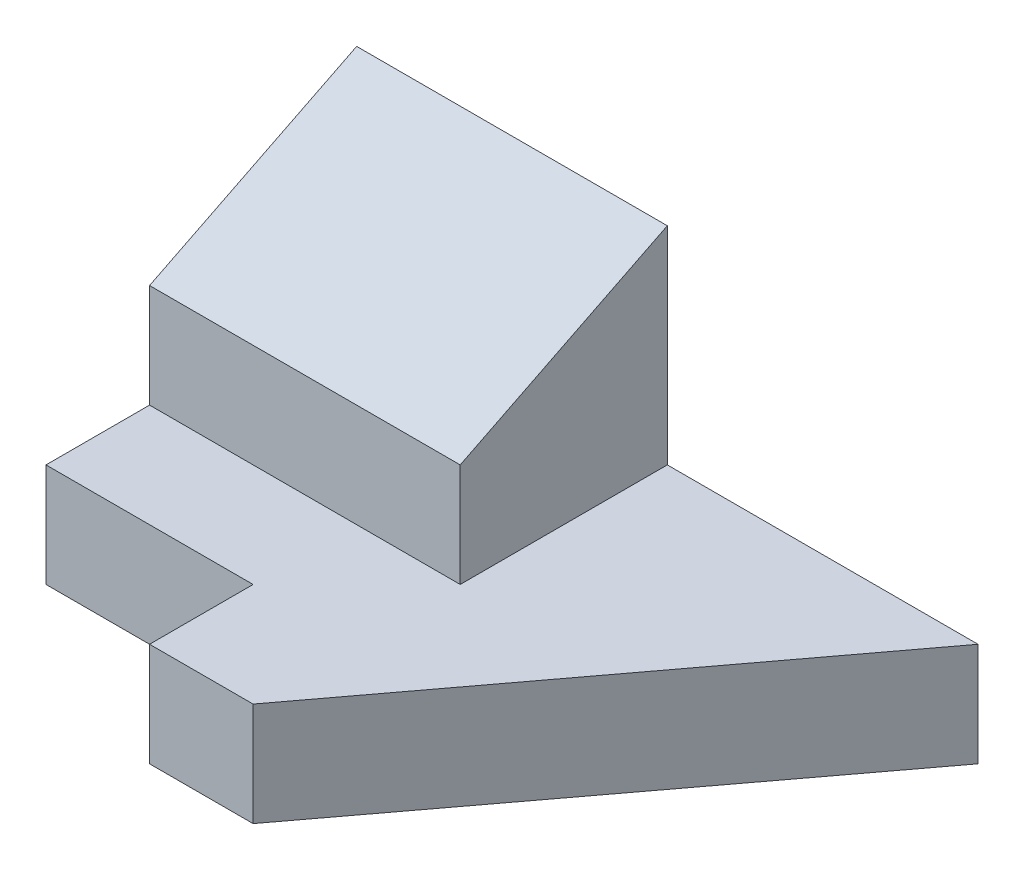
SolidWorks part; units mm, degrees
ref_plane "Front Plane" through (0, 0, 0) normal (0, 0, 1) x (1, 0, 0)
ref_plane "Top Plane" through (0, 0, 0) normal (0, 1, 0) x (1, 0, 0)
ref_plane "Right Plane" through (0, 0, 0) normal (1, 0, 0) x (0, 0, -1)
sketch "Sketch1" plane through (0, 0, 0) normal (0, 1, 0) x (1, 0, 0)
  line L0 (0, 0) -> (20, 0)
  line L1 (20, 0) -> (20, -10)
  line L2 (20, -10) -> (30, -10)
  line L3 (30, -10) -> (60, 30)
  line L4 (60, 30) -> (0, 30)
  line L5 (0, 30) -> (0, 0)
  dimension "D1" = 10
  dimension "D2" = 10
  dimension "D3" = 30
  dimension "D4" = 60
  dimension "D5" = 20
extrude "Extrude1" add sketch "Sketch1" along normal blind 10
sketch "Sketch2" plane through (0, 0, 0) normal (1, 0, 0) x (0, 0, -1)
  line L0 (30, 10) -> (30, 30)
  line L1 (30, 30) -> (10, 20)
  line L2 (10, 20) -> (10, 10)
  line L3 (30, 10) -> (0, 10) construction
  line L4 (10, 10) -> (30, 10)
  line L5 (30, 0) -> (0, 0) construction
  dimension "D1" = 20
  dimension "D2" = 30
  dimension "D3" = 10
extrude "Extrude2" add sketch "Sketch2" along normal blind 30
